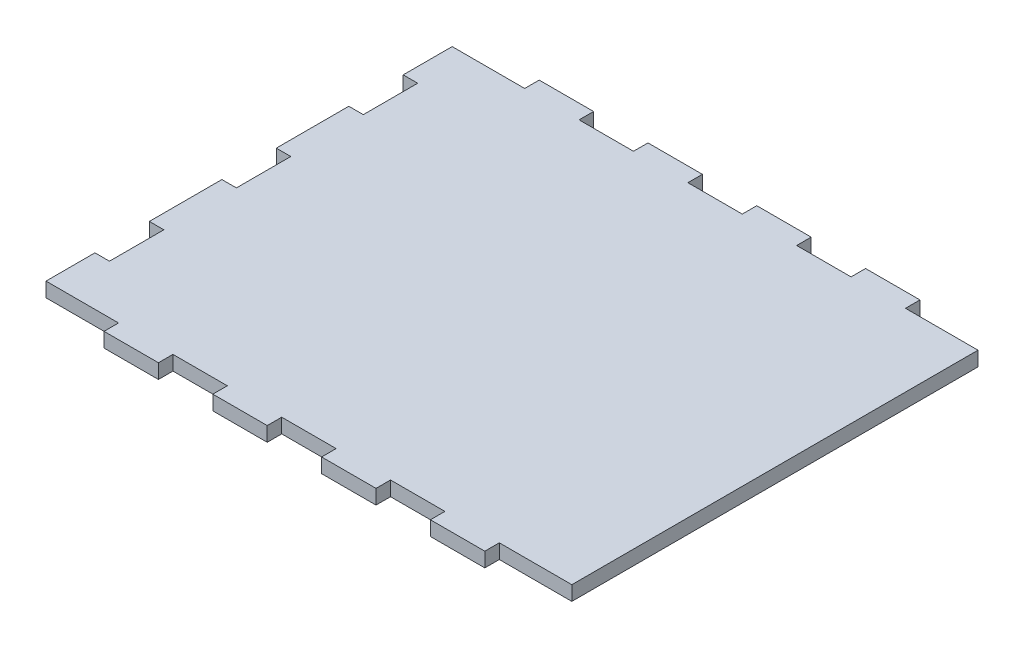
SolidWorks part; units mm, degrees
ref_plane "Alzado" through (0, 0, 0) normal (0, 0, 1) x (1, 0, 0)
ref_plane "Planta" through (0, 0, 0) normal (0, 1, 0) x (1, 0, 0)
ref_plane "Vista lateral" through (0, 0, 0) normal (1, 0, 0) x (0, 0, -1)
sketch "Sketch1" plane through (0, 0, 0) normal (0, 1, 0) x (1, 0, 0)
  line L1 (0, 0) -> (145, 0)
  line L2 (0, 0) -> (0, 120)
  line L3 (0, 120) -> (145, 120)
  line L4 (145, 0) -> (145, 120)
  dimension "D1" = 120
  dimension "D2" = 145
extrude "Boss-Extrude1" add sketch "Sketch1" along normal blind 4
sketch "Sketch2" plane through (0, 4, 0) normal (0, 1, 0) x (1, 0, 0)
  line L0 (0, 0) -> (145, 0) construction
  line L1 (0, 0) -> (20, 0)
  line L2 (0, 0) -> (0, 4)
  line L3 (0, 4) -> (20, 4)
  line L4 (20, 0) -> (20, 4)
  line L5 (35, 0) -> (50, 0)
  line L6 (35, 0) -> (35, 4)
  line L7 (35, 4) -> (50, 4)
  line L8 (50, 0) -> (50, 4)
  line L9 (95, 0) -> (110, 0)
  line L10 (65, 0) -> (80, 0)
  line L11 (65, 0) -> (65, 4)
  line L12 (65, 4) -> (80, 4)
  line L13 (80, 0) -> (80, 4)
  line L14 (125, 0) -> (145, 0)
  line L15 (125, 0) -> (125, 4)
  line L16 (125, 4) -> (145, 4)
  line L17 (145, 0) -> (145, 4)
  line L18 (95, 0) -> (95, 4)
  line L19 (95, 4) -> (110, 4)
  line L20 (110, 0) -> (110, 4)
  point P19 (20, 2)
  point P20 (0, 0)
  point P21 (0, 0)
  point P27 (0, 0)
  point P28 (80, 2)
  dimension "D1" = 20
  dimension "D2" = 4
  dimension "D3" = 15
  dimension "D4" = 4
  dimension "D5" = 15
  dimension "D6" = 15
  dimension "D7" = 15
  dimension "D8" = 4
  dimension "D9" = 20
  dimension "D10" = 4
  dimension "D11" = 4
  dimension "D12" = 15
  dimension "D13" = 15
extrude "Cut-Extrude1" cut sketch "Sketch2" against normal through all both and the other way through all
sketch "Sketch3" plane through (0, 4, 0) normal (0, 1, 0) x (1, 0, 0)
  line L0 (0, 120) -> (0, 4) construction
  line L1 (0, 102.5) -> (4, 102.5)
  line L2 (0, 102.5) -> (0, 87.5)
  line L3 (0, 87.5) -> (4, 87.5)
  line L4 (4, 102.5) -> (4, 87.5)
  line L5 (145, 120) -> (0, 120) construction
  line L7 (0, 67.5) -> (4, 67.5)
  line L8 (0, 67.5) -> (0, 52.5)
  line L9 (0, 52.5) -> (4, 52.5)
  line L10 (4, 67.5) -> (4, 52.5)
  line L11 (0, 32.5) -> (4, 32.5)
  line L12 (0, 32.5) -> (0, 17.5)
  line L13 (0, 17.5) -> (4, 17.5)
  line L14 (4, 32.5) -> (4, 17.5)
  line L15 (20, 0) -> (35, 0) construction
  dimension "D1" = 4
  dimension "D2" = 15
  dimension "D3" = 17.5
  dimension "D4" = 15
  dimension "D5" = 4
  dimension "D6" = 17.5
  dimension "D7" = 20
  dimension "D8" = 15
  dimension "D9" = 4
extrude "Cut-Extrude2" cut sketch "Sketch3" against normal through all both and the other way through all
ref_plane "Plane1" through (0, 0, -60) normal (0, 0, -1) x (-1, 0, 0)
mirror "Mirror1" about plane through (0, 0, -60) normal (0, 0, -1) of "Cut-Extrude1"
